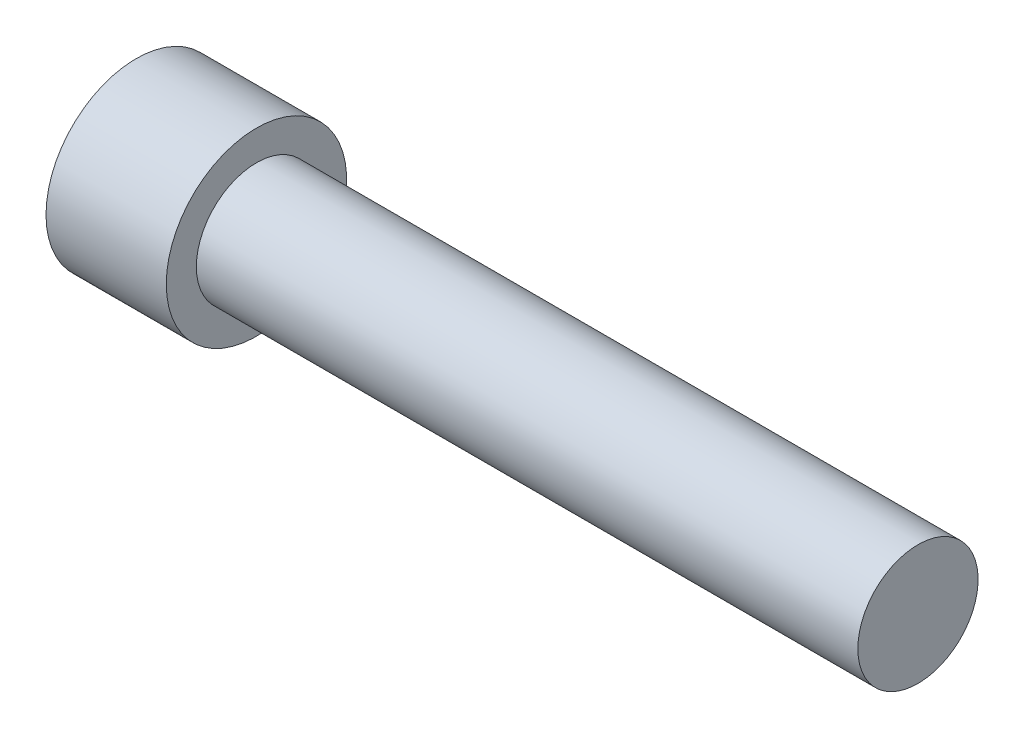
SolidWorks part; units mm, degrees
ref_plane "Front Plane" through (0, 0, 0) normal (0, 0, 1) x (1, 0, 0)
ref_plane "Top Plane" through (0, 0, 0) normal (0, 1, 0) x (1, 0, 0)
ref_plane "Right Plane" through (0, 0, 0) normal (1, 0, 0) x (0, 0, -1)
sketch "Sketch1" plane through (0, 0, 0) normal (0, 0, 1) x (1, 0, 0)
  line L0 (-31.6838, -2) -> (-31.6838, 1)
  line L1 (-31.6838, 1) -> (-27.6838, 1)
  line L2 (-27.6838, 1) -> (-27.6838, 0)
  line L3 (-27.6838, 0) -> (-5.6838, 0)
  line L7 (-31.6838, -2) -> (-5.6838, -2)
  line L8 (-5.6838, 0) -> (-5.6838, -2)
  dimension "D1" = 3
revolve "Revolve1" add sketch "Sketch1" angle 360 about L7
sketch "Sketch2" plane through (-31.6838, 0, 0) normal (-1, 0, 0) x (0, 0, 1)
  line L1 (1.1087, -0.2767) -> (-0.9785, -0.2015)
  line L2 (-0.9785, -0.2015) -> (-2.0872, -1.9715)
  line L3 (-2.0872, -1.9715) -> (-1.1087, -3.8166)
  line L4 (-1.1087, -3.8166) -> (0.9785, -3.8918)
  line L5 (0.9785, -3.8918) -> (2.0872, -2.1218)
  line L6 (2.0872, -2.1218) -> (1.1087, -0.2767)
  circle A0 centre (0, -2.0466) radius 1.8087 construction
extrude "Cut-Extrude1" cut sketch "Sketch2" against normal blind 3
